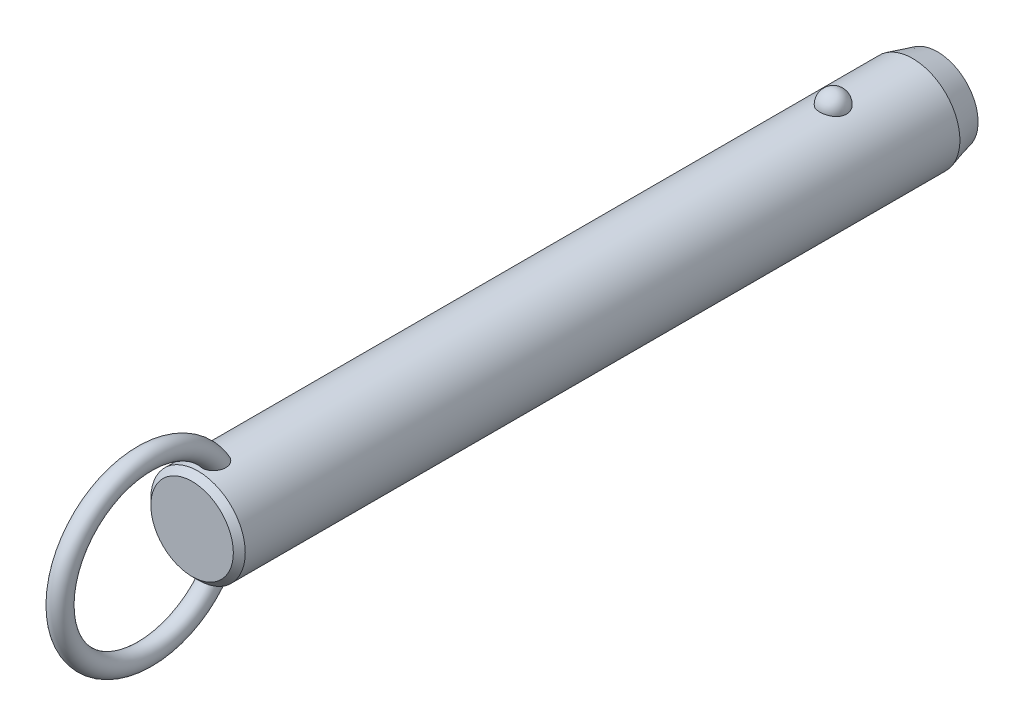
SolidWorks part; units mm, degrees
ref_plane "Front Plane" through (0, 0, 0) normal (0, 0, 1) x (1, 0, 0)
ref_plane "Top Plane" through (0, 0, 0) normal (0, 1, 0) x (1, 0, 0)
ref_plane "Right Plane" through (0, 0, 0) normal (1, 0, 0) x (0, 0, -1)
sketch "Sketch2" plane through (0, 0, 0) normal (0, 0, 1) x (1, 0, 0)
  circle A0 centre (0, 0) radius 9.5
  point P3 (0, 9.5)
  dimension "D1" = 19
extrude "Boss-Extrude1" add sketch "Sketch2" along normal blind 116.8
sketch "Sketch3" plane through (0, 0, 0) normal (0, 0, -1) x (-1, 0, 0)
  circle A0 centre (0, 0) radius 9.5
  dimension "D1" = 19
extrude "Boss-Extrude2" add sketch "Sketch3" along normal blind 23.7
chamfer "Chamfer1" distance 5 angle 15 1 edges at (-9.5, 0, -23.7)
sketch "Sketch12" plane through (0, 0, 0) normal (1, 0, 0) x (0, 0, -1)
  line L0 (-116.8, 9.5) -> (-116.8, -9.5) construction
  point P0 (-116.8, 0)
sketch "Sketch13" plane through (0, 0, 0) normal (1, 0, 0) x (0, 0, -1)
  circle A0 centre (-135.85, 0) radius 19.05
  point P2 (-116.8, 0)
  dimension "D1" = 38.1
sketch "Sketch14" plane through (0, 0, 0) normal (0, 1, 0) x (1, 0, 0)
  circle A0 centre (0, -118.8) radius 2
  point P2 (0, -116.8)
  dimension "D1" = 4
sweep "Sweep1" add profiles "Sketch14" path "Sketch13"
sketch "Sketch15" plane through (0, 0, 116.8) normal (0, 0, 1) x (1, 0, 0)
  circle A0 centre (0, 0) radius 9.5
  dimension "D1" = 19
extrude "Boss-Extrude3" add sketch "Sketch15" along normal blind 9.52
chamfer "Chamfer2" distance 1.2 angle 45 1 edges at (9.5, 0, 126.32)
sketch "Sketch18" plane through (0, 0, 0) normal (1, 0, 0) x (0, 0, -1)
  line L0 (18.7, 9.5) -> (-119.3378, 9.5) construction
  line L1 (2.7, 12.2) -> (2.7, 6.8)
  line L2 (-119.3378, -9.5) -> (18.7, -9.5) construction
  arc A0 (2.7, 12.2) -> (2.7, 6.8) centre (2.7, 9.5) ccw
  point P4 (0, 9.5)
  dimension "D1" = 21.7
revolve "Revolve1" add sketch "Sketch18" angle 360 about L1
